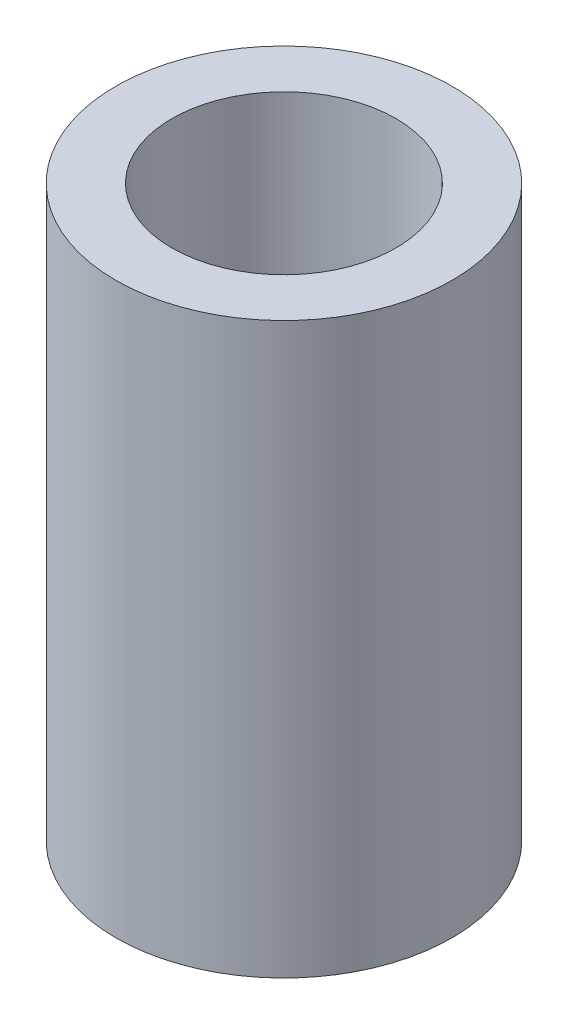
SolidWorks part; units mm, degrees
ref_plane "Front Plane" through (0, 0, 0) normal (0, 0, 1) x (1, 0, 0)
ref_plane "Top Plane" through (0, 0, 0) normal (0, 1, 0) x (1, 0, 0)
ref_plane "Right Plane" through (0, 0, 0) normal (1, 0, 0) x (0, 0, -1)
sketch "Sketch2" plane through (0, 0, 0) normal (0, 1, 0) x (1, 0, 0)
  circle A0 centre (0, 0) radius 5
  circle A1 centre (0, 0) radius 7.5
  dimension "D1" = 10
  dimension "D2" = 15
extrude "Boss-Extrude1" add sketch "Sketch2" along normal blind 25.4
